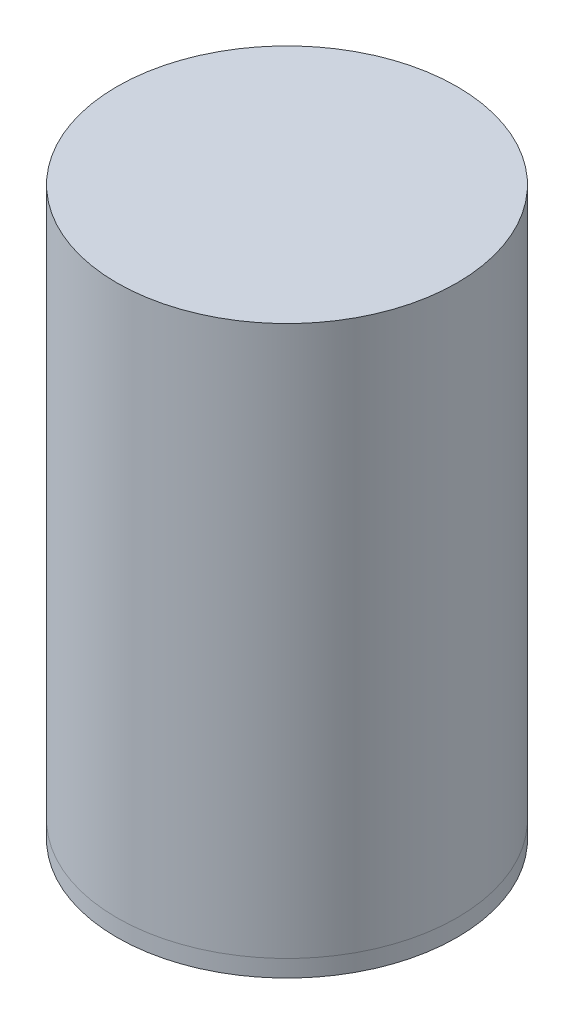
SolidWorks part; units mm, degrees
ref_plane "Alzado" through (0, 0, 0) normal (0, 0, 1) x (1, 0, 0)
ref_plane "Planta" through (0, 0, 0) normal (0, 1, 0) x (1, 0, 0)
ref_plane "Vista lateral" through (0, 0, 0) normal (1, 0, 0) x (0, 0, -1)
sketch "Croquis1" plane through (0, 0, 0) normal (0, 1, 0) x (1, 0, 0)
  circle A0 centre (0, 0) radius 30
  dimension "D1" = 60
extrude "Saliente-Extruir1" add sketch "Croquis1" against normal blind 97
shell "Vaciado1" thickness 1.5
sketch "Croquis2" plane through (0, 0, 0) normal (0, 0, 1) x (1, 0, 0)
  line L0 (-30, -97) -> (30, -97) construction
  line L1 (-26, -100) -> (-30, -100)
  line L3 (-28.5353, -97) -> (-30, -97)
  line L4 (-30, -100) -> (-30, -97)
  line L7 (-26, -100) -> (-20, -94)
  line L8 (-20, -94) -> (-28.5353, -94)
  line L9 (-28.5353, -94) -> (-28.5353, -97)
  line L10 (-28.5353, -97) -> (-30, -97)
  line L11 (0, -89.1405) -> (0, -95.6162) construction
  point P0 (0, -98.3106)
  dimension "D1" = 4
  dimension "D2" = 10
  dimension "D3" = 6
  dimension "D4" = 3
revolve "Revolución1" add sketch "Croquis2" angle 360 about L11
sketch "Croquis3" plane through (0, -94, 0) normal (0, 1, 0) x (1, 0, 0)
  circle A0 centre (0, 0) radius 25
  circle A1 centre (0, 0) radius 18
  dimension "D1" = 50
  dimension "D2" = 36
extrude "Saliente-Extruir2" add sketch "Croquis3" along normal blind 3 separate body
sketch "Croquis4" plane through (0, -94, 0) normal (0, -1, 0) x (1, 0, 0)
  circle A0 centre (0, 0) radius 18
extrude "Saliente-Extruir3" add sketch "Croquis4" against normal blind 1 separate body
